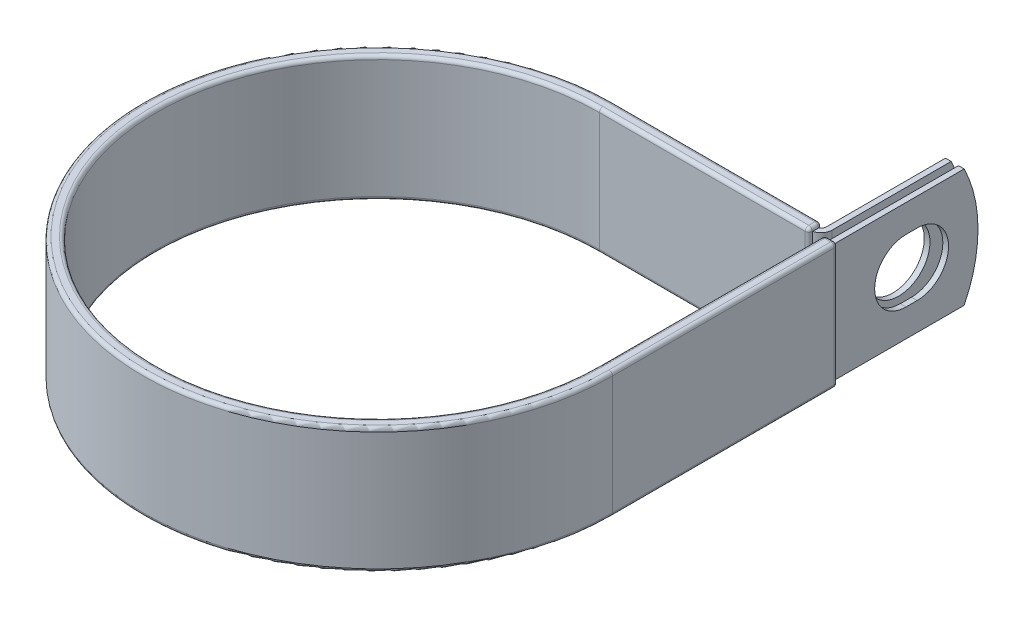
SolidWorks part; units mm, degrees
ref_plane "Front Plane" through (0, 0, 0) normal (0, 0, 1) x (1, 0, 0)
ref_plane "Top Plane" through (0, 0, 0) normal (0, 1, 0) x (1, 0, 0)
ref_plane "Right Plane" through (0, 0, 0) normal (1, 0, 0) x (0, 0, -1)
sketch "Sketch1" plane through (0, 0, 0) normal (0, 1, 0) x (1, 0, 0)
  line L0 (0, 48.4187) -> (44.4665, 48.4187)
  line L1 (48.4187, 0) -> (48.4187, 48.4187)
  line L2 (46.8439, 79.3496) -> (46.8439, 50.7962)
  line L5 (48.4187, 48.4187) -> (48.4187, 79.3496)
  arc A0 (0, 48.4187) -> (48.4187, 0) centre (0, 0) ccw
  arc A3 (44.4665, 48.4187) -> (46.8439, 50.7962) centre (44.4665, 50.7962) ccw
extrude "Extrude-Thin1" add sketch "Sketch1" along normal mid plane 25.4 thin
sketch "Sketch2" plane through (45.6247, 0, 0) normal (-1, 0, 0) x (0, 0, 1)
  line L0 (-79.3496, 12.7) -> (-79.3496, -12.7) construction
  line L7 (0, 12.7) -> (0, -12.7) construction
  circle A0 centre (-65.0748, 0) radius 6.7437
  point P2 (-79.3496, 0)
extrude "Cut-Extrude1" cut sketch "Sketch2" against normal up to surface (1.2192 mm away)
sketch "Sketch3" plane through (49.6379, 0, 0) normal (1, 0, 0) x (0, 0, -1)
  line L0 (63.881, 0) -> (66.2686, 0) construction
  line L1 (63.881, 6.7437) -> (66.2686, 6.7437)
  line L2 (63.881, -6.7437) -> (66.2686, -6.7437)
  line L3 (79.3496, 12.7) -> (79.3496, -12.7) construction
  arc A0 (63.881, 6.7437) -> (63.881, -6.7437) centre (63.881, 0) ccw
  arc A1 (66.2686, -6.7437) -> (66.2686, 6.7437) centre (66.2686, 0) ccw
  point P3 (65.0748, 0)
  point P8 (79.3496, 0)
  point P11 (57.1373, 0)
  point P12 (73.0123, 0)
extrude "Cut-Extrude2" cut sketch "Sketch3" against normal up to surface (1.2192 mm away)
sketch "Sketch4" plane through (45.6247, 0, 0) normal (-1, 0, 0) x (0, 0, 1)
  line L0 (-79.3496, 12.7) -> (-79.3496, -12.7)
  line L1 (-79.3496, 12.7) -> (-76.3723, 12.7)
  line L2 (-79.3496, 12.7) -> (-50.7962, 12.7) construction
  line L3 (-79.3496, -12.7) -> (-76.3723, -12.7)
  line L4 (-79.3496, -12.7) -> (-50.7962, -12.7) construction
  arc A0 (-76.3723, 12.7) -> (-76.3723, -12.7) centre (-50.7746, 0) ccw
extrude "Cut-Extrude3" cut sketch "Sketch4" against normal through all contours A0 M4 M5 | A0 L0 M2
ref_plane "Plane1" through (0, 0, -48.4187) normal (0, 0, 1) x (1, 0, 0)
ref_plane "Plane2" through (0, 0, 0) normal (-1, 0, 0) x (0, 0, 1)
sketch "Sketch5" plane through (0, 0, -48.4187) normal (0, 0, 1) x (1, 0, 0)
  line L0 (48.4187, 12.7) -> (49.6379, 12.7)
  line L1 (48.4187, -12.7) -> (48.4187, 12.7)
  line L2 (47.625, -12.7317) -> (47.625, 12.7317)
  line L3 (49.6379, 12.7) -> (49.6379, -12.7)
  line L4 (49.6379, -12.7) -> (48.4187, -12.7)
  line L5 (48.387, 13.4937) -> (49.6697, 13.4937)
  line L7 (50.4317, 12.7317) -> (50.4317, -12.7317)
  line L8 (49.6697, -13.4937) -> (48.387, -13.4937)
  line L9 (47.625, -13.4937) -> (47.625, 13.4937) construction
  line L11 (50.4317, -13.4937) -> (47.625, -13.4937) construction
  line L12 (50.4317, 13.4937) -> (50.4317, -13.4937) construction
  line L13 (47.625, 13.4937) -> (50.4317, 13.4937) construction
  arc A0 (47.625, -12.7317) -> (48.387, -13.4937) centre (48.387, -12.7317) ccw
  arc A1 (50.4317, -12.7317) -> (49.6697, -13.4937) centre (49.6697, -12.7317) cw
  arc A2 (47.625, 12.7317) -> (48.387, 13.4937) centre (48.387, 12.7317) cw
  arc A3 (49.6697, 13.4937) -> (50.4317, 12.7317) centre (49.6697, 12.7317) cw
sketch "Sketch6" plane through (0, 12.7, 0) normal (0, 1, 0) x (1, 0, 0)
  line L0 (47.625, 0) -> (47.625, 48.4187)
  line L1 (0, 47.625) -> (44.9898, 47.625)
  line L2 (45.6247, 76.3723) -> (45.6247, 50.7962) construction
  arc A0 (0, 47.625) -> (47.625, 0) centre (0, 0) ccw
sweep "Sweep1" add profiles "Sketch5" path "Sketch6"
fillet "Fillet1" radius 0.762 16 edges at (44.9898, 13.2706, -50.2085) (44.9898, 0, -50.4317) (44.9898, -13.2706, -50.2085) (44.9898, -13.4937, -49.0283) (44.9898, -13.2706, -47.8482) (44.9898, 0, -47.625) (44.9898, 13.2706, -47.8482) (50.2085, 13.2706, -48.4187) (50.4317, 0, -48.4187) (50.2085, -13.2706, -48.4187) (49.0283, -13.4937, -48.4187) (47.8482, -13.2706, -48.4187) (47.625, 0, -48.4187) (47.8482, 13.2706, -48.4187) (44.9898, 13.4937, -49.0283) (49.0283, 13.4937, -48.4187)
equation "\"D4@Sketch5\" = \"D1@Extrude-Thin1\""
equation "\"D5@Sketch5\" = \"D5@Extrude-Thin1\""
equation "\"D1@Sketch3\" = \"D2@Sketch2\""
equation "\"D7@Sketch1\" = \"D3@Sketch2\" + \"D1@Sketch3\""
equation "\"D1@Sketch1\" = \"D1@Sketch6\" + 2 * \"D3@Sketch5\""
equation "\"D1@Sketch4\" = ( \"D1@Extrude-Thin1\" + .125 ) * 2"
equation "\"D2@Sketch1\"=1.95*\"D5@Extrude-Thin1\""
equation "\"D2@Sketch3\" = \"D1@Sketch2\""
